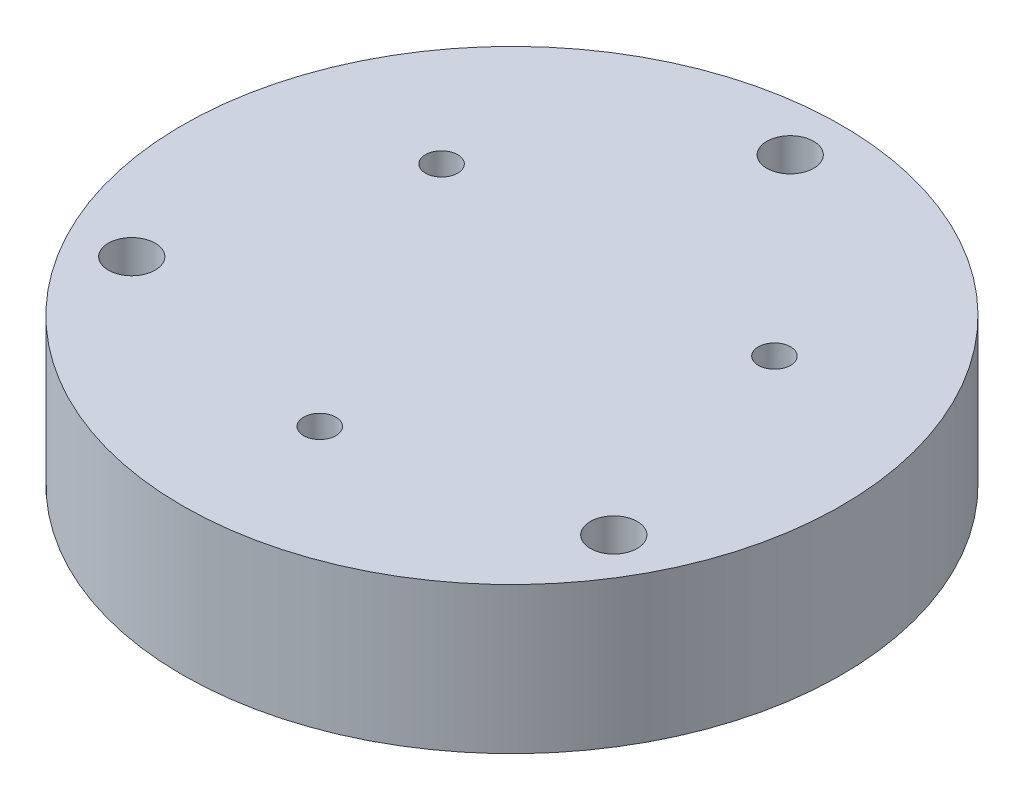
SolidWorks part; units mm, degrees
ref_plane "Plan de face" through (0, 0, 0) normal (0, 0, 1) x (1, 0, 0)
ref_plane "Plan de dessus" through (0, 0, 0) normal (0, 1, 0) x (1, 0, 0)
ref_plane "Plan de droite" through (0, 0, 0) normal (1, 0, 0) x (0, 0, -1)
sketch "Esquisse1" plane through (0, 0, 0) normal (0, 1, 0) x (1, 0, 0)
  line L0 (0, -43.0614) -> (0, 52.4368) construction
  line L1 (-42.5164, 0) -> (97.8966, 0) construction
  circle A0 centre (0, 0) radius 22.5
  circle A1 centre (0, 0) radius 19 construction
  circle A2 centre (0, 19) radius 1.6
  circle A3 centre (16.4545, -9.5) radius 1.6
  circle A4 centre (-16.4545, -9.5) radius 1.6
  circle A5 centre (0, 0) radius 13.2 construction
  circle A6 centre (0, -13.1192) radius 1.1
  circle A7 centre (-11.3616, 6.5596) radius 1.1
  circle A8 centre (11.3616, 6.5596) radius 1.1
extrude "Extrusion1" add sketch "Esquisse1" along normal blind 10
sketch "Esquisse2" plane through (0, 0, 0) normal (0, -1, 0) x (1, 0, 0)
  circle A0 centre (0, 0) radius 15.7
extrude "Enlèv. mat.-Extru.1" cut sketch "Esquisse2" against normal blind 2
sketch "Esquisse3" plane through (0, 2, 0) normal (0, -1, 0) x (1, 0, 0)
  circle A0 centre (0, 0) radius 10.5
extrude "Enlèv. mat.-Extru.2" cut sketch "Esquisse3" against normal blind 6
